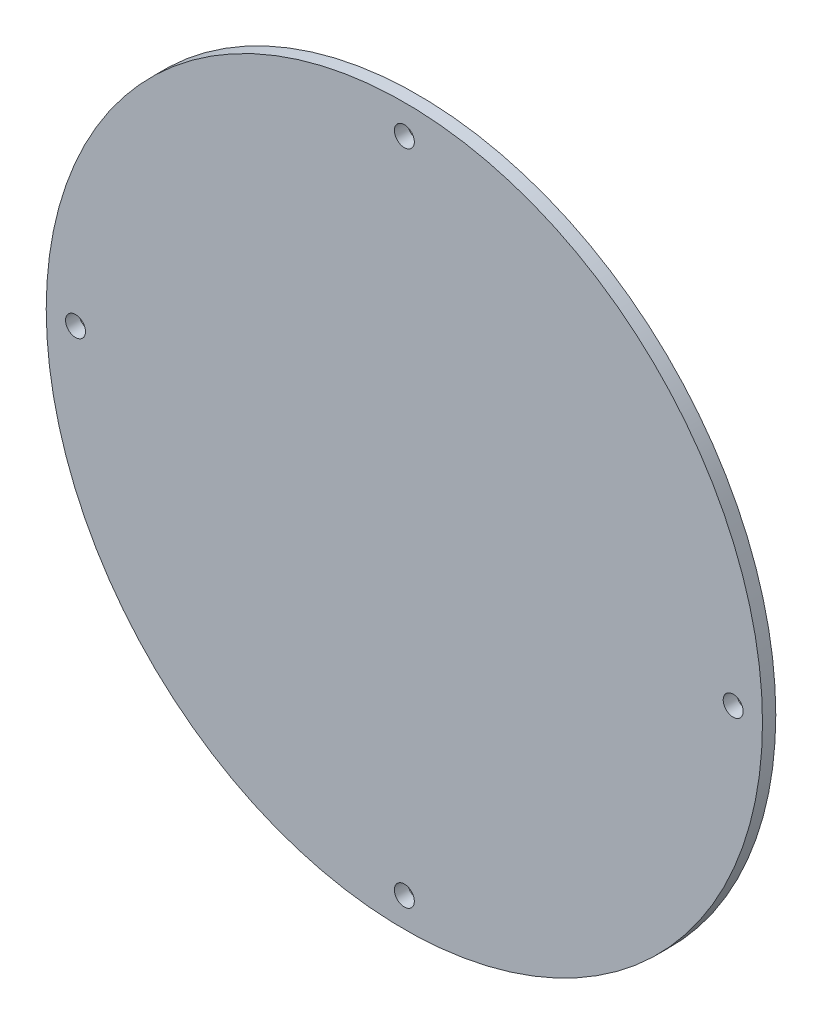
SolidWorks part; units mm, degrees
ref_plane "Front Plane" through (0, 0, 0) normal (0, 0, 1) x (1, 0, 0)
ref_plane "Top Plane" through (0, 0, 0) normal (0, 1, 0) x (1, 0, 0)
ref_plane "Right Plane" through (0, 0, 0) normal (1, 0, 0) x (0, 0, -1)
sketch "Sketch1" plane through (0, 0, 0) normal (0, 0, 1) x (1, 0, 0)
  line L0 (0, 78.5) -> (0, 0) construction
  line L1 (-78.5, 0) -> (-1.5065, 0) construction
  circle A0 centre (0, 0) radius 85.5
  circle A1 centre (0, 78.5) radius 2.3812
  circle A2 centre (78.5, 0) radius 2.3813
  circle A3 centre (0, -78.5) radius 2.3812
  circle A4 centre (-78.5, 0) radius 2.3813
  point P14 (0, 0)
  dimension "D1" = 171
  dimension "D2" = 4.7625
  dimension "D3" = 78.5
  dimension "D5" = 78.5
  dimension "D4" = 4
extrude "Boss-Extrude1" add sketch "Sketch1" along normal blind 3.175 contours A0 A4 A3 A2 A1
